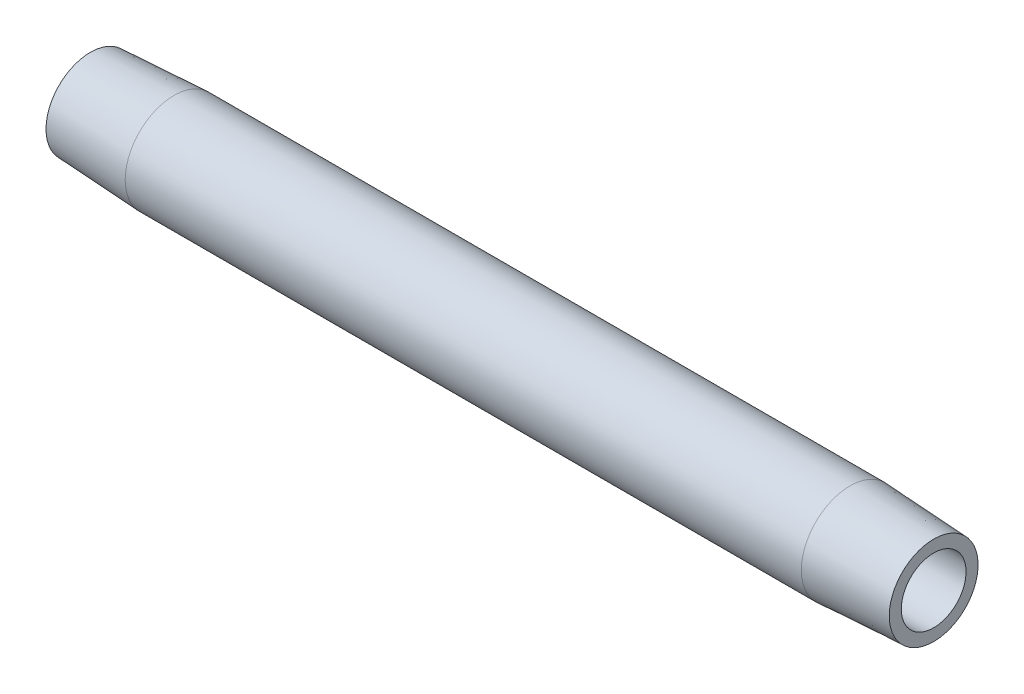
SolidWorks part; units mm, degrees
ref_plane "Front Plane" through (0, 0, 0) normal (0, 0, 1) x (1, 0, 0)
ref_plane "Top Plane" through (0, 0, 0) normal (0, 1, 0) x (1, 0, 0)
ref_plane "Right Plane" through (0, 0, 0) normal (1, 0, 0) x (0, 0, -1)
sketch "Sketch2" plane through (0, 0, 0) normal (0, 0, 1) x (1, 0, 0)
  line L0 (0.4761, 0) -> (50000.4761, 0) construction
  line L1 (0, -11.3625) -> (0, 49988.6375) construction
  line L7 (8.81, 5.1435) -> (0, 4.6818)
  line L8 (80.09, 5.1435) -> (8.81, 5.1435)
  line L9 (88.9, 4.6818) -> (80.09, 5.1435)
  line L10 (88.9, 3.4163) -> (88.9, 4.6818)
  line L11 (88.9, 3.4163) -> (0, 3.4163)
  line L12 (0, 4.6818) -> (0, 3.4163)
  dimension "D1" = 6.8326
  dimension "D2" = 10.287
  dimension "D3" = 3
  dimension "D4" = 3
  dimension "D5" = 8.81
  dimension "D6" = 8.81
  dimension "D7" = 88.9
revolve "Revolve1" add sketch "Sketch2" angle 360 about L0
